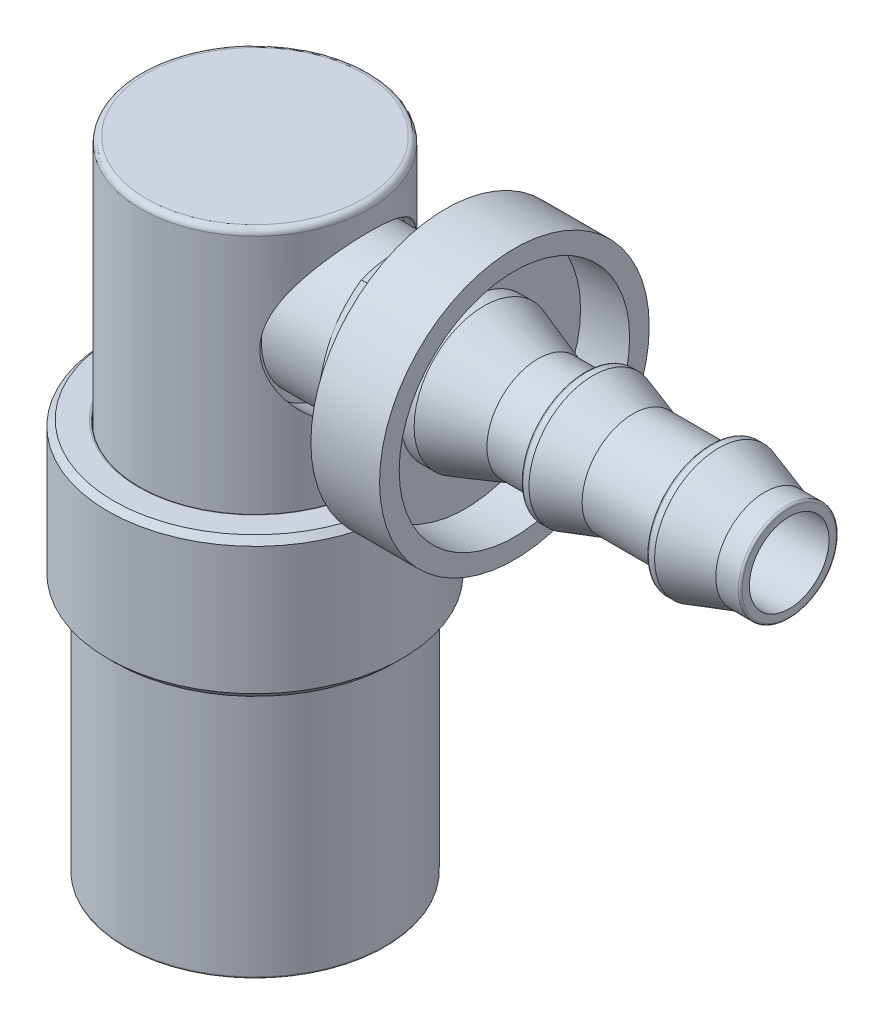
SolidWorks part; units mm, degrees
other "Body"
ref_plane "Front Plane" through (0, 0, 0) normal (0, 0, 1) x (1, 0, 0)
ref_plane "Top Plane" through (0, 0, 0) normal (0, 1, 0) x (1, 0, 0)
ref_plane "Right Plane" through (0, 0, 0) normal (1, 0, 0) x (0, 0, -1)
imported_body "SC200S"
imported_body "BODY"
imported_body "PL-BARB"
imported_body "BARB"
imported_body "SLEEVE"
sketch "Sketch1" plane through (0, 0, 0) normal (0, 0, 1) x (1, 0, 0)
  line L0 (-4.7752, 8.1191) -> (-3.175, 7.1952)
  line L1 (-3.175, 7.1952) -> (-3.175, 2.3876)
  line L2 (-3.175, 2.3876) -> (-4.7752, 0.7874)
  line L3 (-4.7752, 0.7874) -> (-4.7752, 8.1191)
  line L4 (0, -0.8989) -> (0, 6.6198) construction
  line L5 (0, 8.1191) -> (0, 0.7874) construction
  line L6 (-5.0546, 8.2804) -> (-4.7752, 8.1191) construction
  line L7 (-4.7752, 0.7874) -> (-5.5626, 0) construction
  dimension "D1" = 6.35
revolve "Revolve1" add sketch "Sketch1" angle 360 about L4
sketch "Sketch2" plane through (0, 0, 0) normal (0, -1, 0) x (1, 0, 0)
  line L1 (-4.572, 2.6396) -> (-4.572, -2.6396)
  line L2 (-4.572, -2.6396) -> (0, -5.2793)
  line L3 (0, -5.2793) -> (4.572, -2.6396)
  line L4 (4.572, -2.6396) -> (4.572, 2.6396)
  line L5 (4.572, 2.6396) -> (0, 5.2793)
  line L6 (0, 5.2793) -> (-4.572, 2.6396)
  circle A0 centre (0, 0) radius 4.572 construction
  dimension "D1" = 9.144
extrude "Cut-Extrude1" cut sketch "Sketch2" against normal up to surface and the other way through all
